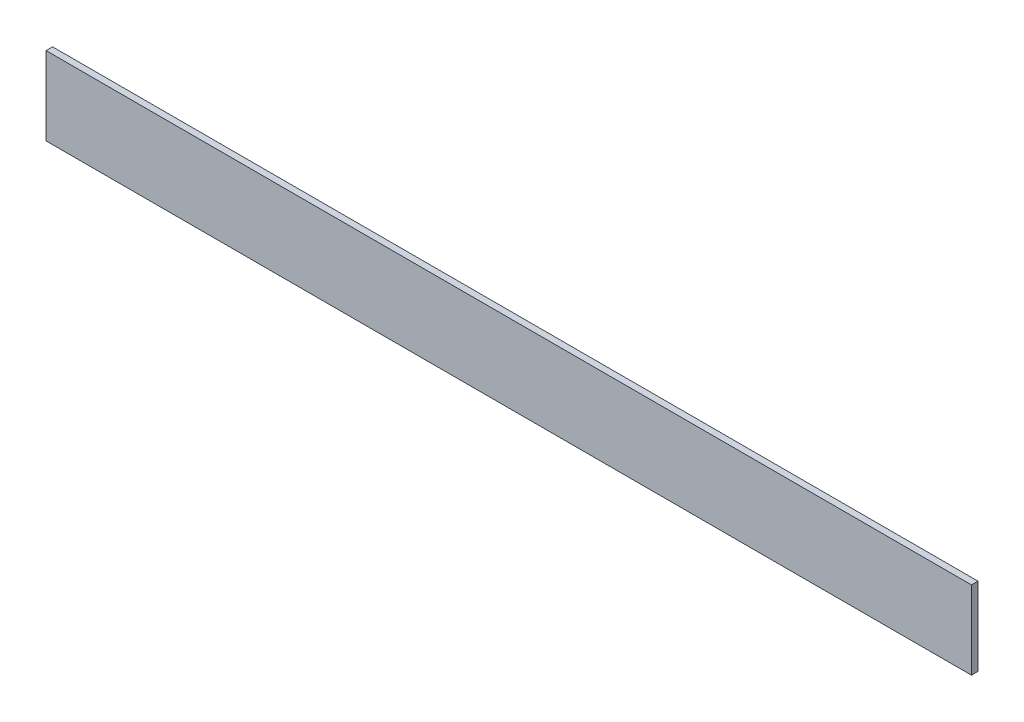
SolidWorks part; units mm, degrees
ref_plane "Front Plane" through (0, 0, 0) normal (0, 0, 1) x (1, 0, 0)
ref_plane "Top Plane" through (0, 0, 0) normal (0, 1, 0) x (1, 0, 0)
ref_plane "Right Plane" through (0, 0, 0) normal (1, 0, 0) x (0, 0, -1)
sketch "Sketch1" plane through (0, 0, 0) normal (0, 0, 1) x (1, 0, 0)
  line L1 (-450.85, -38.1) -> (450.85, -38.1)
  line L2 (-450.85, -38.1) -> (-450.85, 38.1)
  line L3 (-450.85, 38.1) -> (450.85, 38.1)
  line L4 (450.85, -38.1) -> (450.85, 38.1)
  line L5 (-450.85, -38.1) -> (450.85, 38.1) construction
  line L6 (-450.85, 38.1) -> (450.85, -38.1) construction
  point P0 (0, 0)
  dimension "D1" = 76.2
  dimension "D2" = 901.7
extrude "Boss-Extrude1" add sketch "Sketch1" along normal blind 6.35
